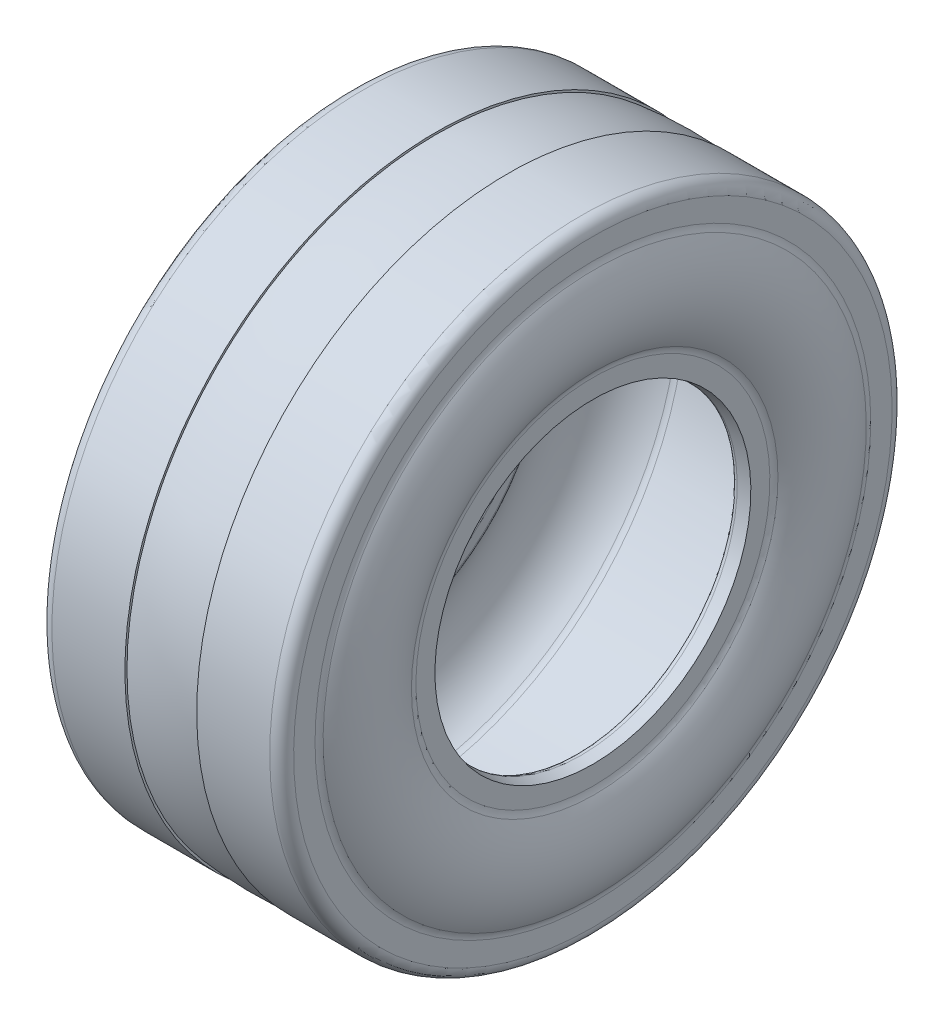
SolidWorks part; units mm, degrees
ref_plane "Plan1" through (0, 0, 0) normal (0, 0, 1) x (1, 0, 0)
ref_plane "Plan2" through (0, 0, 0) normal (0, 1, 0) x (1, 0, 0)
ref_plane "Plan3" through (0, 0, 0) normal (1, 0, 0) x (0, 0, -1)
sketch "Esquisse1" plane through (80, -50, 0) normal (0, 0, 1) x (1, 0, 0)
  line L0 (-67.6459, 16.4793) -> (-37.1459, 16.4793)
  line L1 (-72.6459, -39.592) -> (-72.6459, -47.5207)
  line L2 (-55.7702, 9.4793) -> (11.4785, 9.4793)
  line L3 (-22.1459, 16.4793) -> (-22.1459, -113.5207) construction
  line L4 (-7.1459, 16.4793) -> (-7.1459, 15.611)
  line L5 (-65.4709, -45.8458) -> (-66.996, -39.6915)
  line L6 (28.3541, -47.5207) -> (23.4342, -48.3021)
  line L7 (-80, -113.5207) -> (36.7083, -113.5207) construction
  line L8 (28.3541, 11.4793) -> (28.3541, 2.5506)
  line L9 (21.1792, -45.8458) -> (22.7043, -39.6915)
  line L10 (28.3541, -39.592) -> (28.3541, -47.5207)
  line L11 (-37.1459, 16.4793) -> (-37.1459, 15.611)
  line L12 (-7.1459, 16.4793) -> (23.3541, 16.4793)
  line L15 (-72.6459, 11.4793) -> (-72.6459, 2.5506)
  line L16 (-72.6459, -47.5207) -> (-67.7259, -48.3021)
  arc A0 (-58.1018, 8.9024) -> (-67.9321, -37.7867) centre (-43.6459, -18.5207) ccw
  arc A1 (-73.3959, -0.0833) -> (-73.3959, -36.9581) centre (-43.6459, -18.5207) ccw
  arc A2 (-72.6459, -39.592) -> (-73.3959, -36.9581) centre (-77.6459, -39.592) ccw
  arc A3 (-73.3959, -0.0833) -> (-72.6459, 2.5506) centre (-77.6459, 2.5506) ccw
  arc A4 (-67.6459, 16.4793) -> (-72.6459, 11.4793) centre (-67.6459, 11.4793) ccw
  arc A5 (11.4785, 9.4793) -> (13.8101, 8.9024) centre (11.4785, 4.4793) cw
  arc A6 (-67.9321, -37.7867) -> (-66.996, -39.6915) centre (-71.8492, -40.8942) cw
  arc A7 (-65.4709, -45.8458) -> (-67.7259, -48.3021) centre (-67.4122, -46.3269) cw
  arc A8 (-55.7702, 9.4793) -> (-58.1018, 8.9024) centre (-55.7702, 4.4793) ccw
  arc A9 (21.1792, -45.8458) -> (23.4342, -48.3021) centre (23.1205, -46.3269) ccw
  arc A10 (23.6404, -37.7867) -> (22.7043, -39.6915) centre (27.5575, -40.8942) ccw
  arc A11 (23.3541, 16.4793) -> (28.3541, 11.4793) centre (23.3541, 11.4793) cw
  arc A12 (29.1041, -0.0833) -> (28.3541, 2.5506) centre (33.3541, 2.5506) cw
  arc A13 (28.3541, -39.592) -> (29.1041, -36.9581) centre (33.3541, -39.592) cw
  arc A14 (29.1041, -0.0833) -> (29.1041, -36.9581) centre (-0.6459, -18.5207) cw
  arc A15 (13.8101, 8.9024) -> (23.6404, -37.7867) centre (-0.6459, -18.5207) cw
  arc A16 (-7.1459, 15.611) -> (-37.1459, 15.611) centre (-22.1459, -113.5207) ccw
  point P9 (-72.6459, -38.1166)
  point P15 (-72.6459, 16.4793)
  point P20 (-22.1459, 16.4793)
  point P29 (-64.7449, -48.7756)
  point P49 (-22.1459, 9.4793)
  point P50 (-22.1459, 16.4793)
  dimension "D8" = 130
  dimension "D9" = 5
  dimension "D4" = 62
  dimension "D5" = 70
  dimension "D11" = 5
  dimension "D12" = 2
  dimension "D13" = 5
  dimension "D1" = 64
  dimension "D2" = 29
  dimension "D3" = 29
  dimension "D6" = 8
  dimension "D7" = 101
  dimension "D10" = 30
  dimension "D14" = 7
revolve "Base-Révolution" add sketch "Esquisse1" angle 360 about L7
